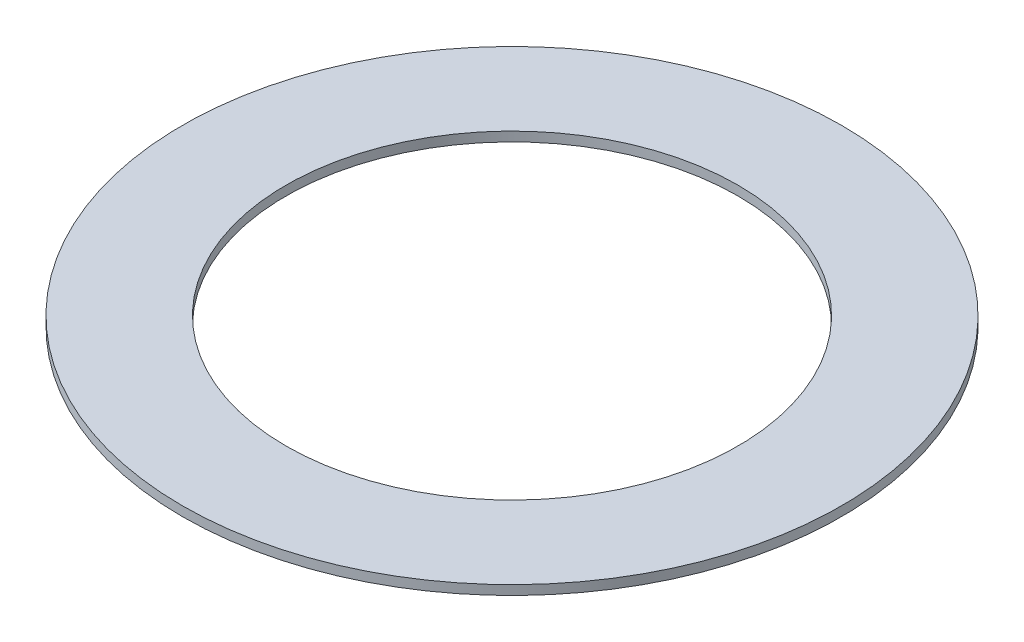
SolidWorks part; units mm, degrees
ref_plane "Front Plane" through (0, 0, 0) normal (0, 0, 1) x (1, 0, 0)
ref_plane "Top Plane" through (0, 0, 0) normal (0, 1, 0) x (1, 0, 0)
ref_plane "Right Plane" through (0, 0, 0) normal (1, 0, 0) x (0, 0, -1)
sketch "Sketch1" plane through (0, 0, 0) normal (0, 1, 0) x (1, 0, 0)
  circle A0 centre (0, 0) radius 19.05
  circle A1 centre (0, 0) radius 27.7813
  dimension "D1" = 55.5625
  dimension "D2" = 38.1
extrude "Boss-Extrude1" add sketch "Sketch1" along normal blind 0.7937
